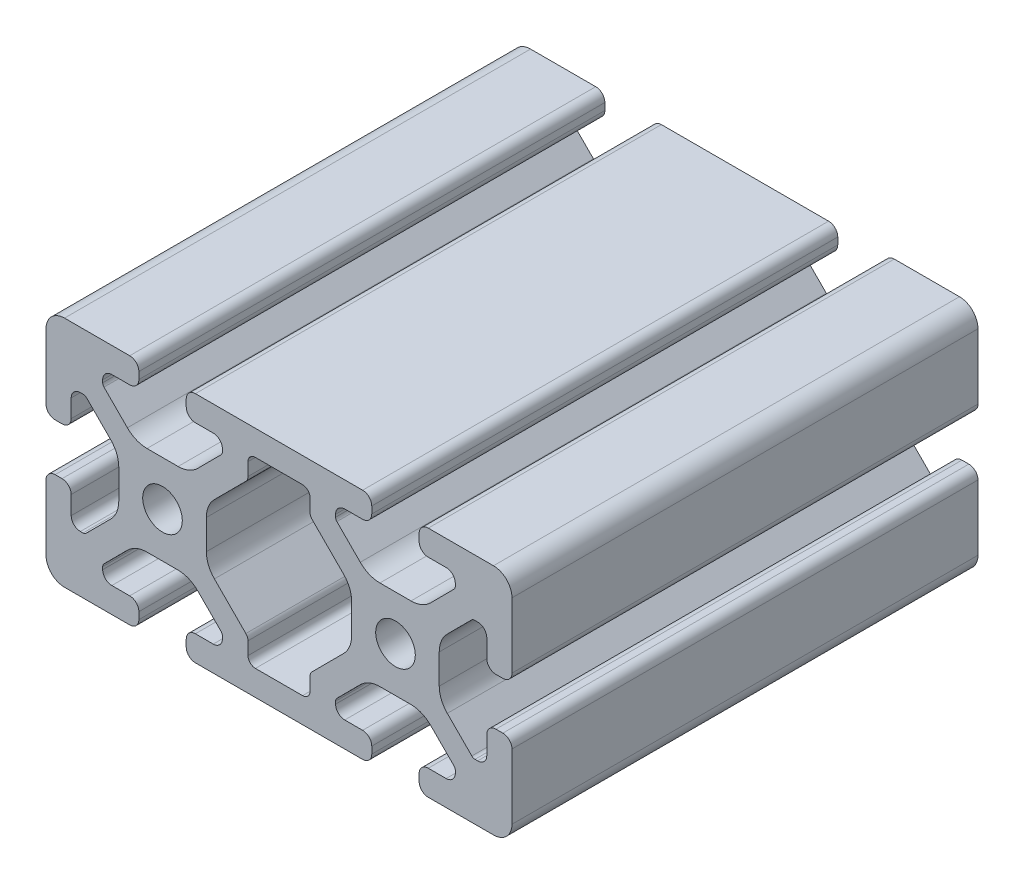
SolidWorks part; units mm, degrees
ref_plane "Front Plane" through (0, 0, 0) normal (0, 0, 1) x (1, 0, 0)
ref_plane "Top Plane" through (0, 0, 0) normal (0, 1, 0) x (1, 0, 0)
ref_plane "Right Plane" through (0, 0, 0) normal (1, 0, 0) x (0, 0, -1)
sketch "Sketch1" plane through (0, 0, 0) normal (0, 0, 1) x (1, 0, 0)
  line L0 (-11.0896, -5.8967) -> (-5.6905, -11.3172)
  line L1 (-12.4742, 2.5438) -> (-12.4742, -2.5446)
  line L2 (-5.6905, 11.3164) -> (-11.0896, 5.8959)
  line L3 (-5.3203, 14.414) -> (-5.3203, 12.2127)
  line L4 (4.0503, 15.684) -> (-4.0503, 15.684)
  line L5 (5.3203, 12.2127) -> (5.3203, 14.414)
  line L6 (11.0896, 5.8959) -> (5.6905, 11.3164)
  line L7 (12.4742, -2.5446) -> (12.4742, 2.5438)
  line L8 (5.6905, -11.3172) -> (11.0896, -5.8967)
  line L9 (5.3203, -14.4147) -> (5.3203, -12.2134)
  line L10 (-4.0503, -15.6847) -> (4.0503, -15.6847)
  line L11 (-5.3203, -12.2134) -> (-5.3203, -14.4147)
  line L12 (15.9245, -18.4422) -> (15.9245, -17.2547)
  line L13 (14.3545, -15.6847) -> (11.2855, -15.6847)
  line L14 (9.7155, -14.1147) -> (9.7155, -13.6719)
  line L15 (9.9371, -13.1355) -> (13.9554, -9.1012)
  line L16 (17.3208, -7.7033) -> (22.6621, -7.7033)
  line L17 (26.0275, -9.1012) -> (30.0459, -13.1355)
  line L18 (30.2674, -13.6719) -> (30.2674, -14.1147)
  line L19 (28.6974, -15.6847) -> (25.6285, -15.6847)
  line L20 (24.0585, -17.2547) -> (24.0585, -18.4422)
  line L21 (25.6285, -20.0122) -> (36.8191, -20.0122)
  line L22 (39.9991, -16.8322) -> (39.9991, -5.6416)
  line L23 (38.4291, -4.0716) -> (37.2416, -4.0716)
  line L24 (35.6716, -5.6416) -> (35.6716, -8.7814)
  line L25 (34.1016, -10.3514) -> (33.6462, -10.3514)
  line L26 (33.1077, -10.1278) -> (28.8933, -5.8967)
  line L27 (27.5087, -2.5446) -> (27.5087, 2.5438)
  line L28 (28.8933, 5.8959) -> (33.0499, 10.069)
  line L29 (33.5884, 10.2927) -> (34.1016, 10.2927)
  line L30 (35.6716, 8.7227) -> (35.6716, 5.6409)
  line L31 (37.2416, 4.0709) -> (38.4291, 4.0709)
  line L32 (39.9991, 5.6409) -> (39.9991, 16.8315)
  line L33 (36.8191, 20.0115) -> (25.6285, 20.0115)
  line L34 (24.0585, 18.4415) -> (24.0585, 17.254)
  line L35 (25.6285, 15.684) -> (28.6974, 15.684)
  line L36 (30.2674, 14.114) -> (30.2674, 13.6712)
  line L37 (30.0459, 13.1348) -> (26.0275, 9.1005)
  line L38 (22.6621, 7.7026) -> (17.3208, 7.7026)
  line L39 (13.9554, 9.1005) -> (9.9371, 13.1348)
  line L40 (9.7155, 13.6712) -> (9.7155, 14.114)
  line L41 (11.2855, 15.684) -> (14.3545, 15.684)
  line L42 (15.9245, 17.254) -> (15.9245, 18.4415)
  line L43 (14.3545, 20.0115) -> (-14.3545, 20.0115)
  line L44 (-15.9245, 18.4415) -> (-15.9245, 17.254)
  line L45 (-14.3545, 15.684) -> (-11.2855, 15.684)
  line L46 (-9.7155, 14.114) -> (-9.7155, 13.6712)
  line L47 (-9.9371, 13.1348) -> (-13.9554, 9.1005)
  line L48 (-17.3208, 7.7026) -> (-22.6621, 7.7026)
  line L49 (-26.0275, 9.1005) -> (-30.0459, 13.1348)
  line L50 (-30.2674, 13.6712) -> (-30.2674, 14.114)
  line L51 (-28.6974, 15.684) -> (-25.6285, 15.684)
  line L52 (-24.0585, 17.254) -> (-24.0585, 18.4415)
  line L53 (-25.6285, 20.0115) -> (-36.8191, 20.0115)
  line L54 (-39.9991, 16.8315) -> (-39.9991, 5.6409)
  line L55 (-38.4291, 4.0709) -> (-37.2416, 4.0709)
  line L56 (-35.6716, 5.6409) -> (-35.6716, 8.7227)
  line L57 (-34.1016, 10.2927) -> (-33.5884, 10.2927)
  line L58 (-33.0499, 10.069) -> (-28.8933, 5.8959)
  line L59 (-27.5087, 2.5438) -> (-27.5087, -2.5446)
  line L60 (-28.8933, -5.8967) -> (-33.1077, -10.1278)
  line L61 (-33.6462, -10.3514) -> (-34.1016, -10.3514)
  line L62 (-35.6716, -8.7814) -> (-35.6716, -5.6416)
  line L63 (-37.2416, -4.0716) -> (-38.4291, -4.0716)
  line L64 (-39.9991, -5.6416) -> (-39.9991, -16.8322)
  line L65 (-36.8191, -20.0122) -> (-25.6285, -20.0122)
  line L66 (-24.0585, -18.4422) -> (-24.0585, -17.2547)
  line L67 (-25.6285, -15.6847) -> (-28.6974, -15.6847)
  line L68 (-30.2674, -14.1147) -> (-30.2674, -13.6719)
  line L69 (-30.0459, -13.1355) -> (-26.0275, -9.1012)
  line L70 (-22.6621, -7.7033) -> (-17.3208, -7.7033)
  line L71 (-13.9554, -9.1012) -> (-9.9371, -13.1355)
  line L72 (-9.7155, -13.6719) -> (-9.7155, -14.1147)
  line L73 (-11.2855, -15.6847) -> (-14.3545, -15.6847)
  line L74 (-15.9245, -17.2547) -> (-15.9245, -18.4422)
  line L75 (-14.3545, -20.0122) -> (14.3545, -20.0122)
  circle A0 centre (20, 0) radius 3.4
  circle A1 centre (-20, 0) radius 3.4
  arc A2 (38.4291, 4.0709) -> (39.9991, 5.6409) centre (38.4291, 5.6409) ccw
  arc A3 (39.9991, -5.6416) -> (38.4291, -4.0716) centre (38.4291, -5.6416) ccw
  arc A4 (37.2416, -4.0716) -> (35.6716, -5.6416) centre (37.2416, -5.6416) ccw
  arc A5 (24.0585, -18.4422) -> (25.6285, -20.0122) centre (25.6285, -18.4422) ccw
  arc A6 (25.6285, -15.6847) -> (24.0585, -17.2547) centre (25.6285, -17.2547) ccw
  arc A7 (15.9245, -18.4422) -> (14.3545, -20.0122) centre (14.3545, -18.4422) cw
  arc A8 (15.9245, -17.2547) -> (14.3545, -15.6847) centre (14.3545, -17.2547) ccw
  arc A9 (35.6716, 5.6409) -> (37.2416, 4.0709) centre (37.2416, 5.6409) ccw
  arc A10 (25.6285, 20.0115) -> (24.0585, 18.4415) centre (25.6285, 18.4415) ccw
  arc A11 (24.0585, 17.254) -> (25.6285, 15.684) centre (25.6285, 17.254) ccw
  arc A12 (14.3545, 15.684) -> (15.9245, 17.254) centre (14.3545, 17.254) ccw
  arc A13 (15.9245, 18.4415) -> (14.3545, 20.0115) centre (14.3545, 18.4415) ccw
  arc A14 (-25.6285, -20.0122) -> (-24.0585, -18.4422) centre (-25.6285, -18.4422) ccw
  arc A15 (-15.9245, -18.4422) -> (-14.3545, -20.0122) centre (-14.3545, -18.4422) ccw
  arc A16 (-14.3545, -15.6847) -> (-15.9245, -17.2547) centre (-14.3545, -17.2547) ccw
  arc A17 (-24.0585, -17.2547) -> (-25.6285, -15.6847) centre (-25.6285, -17.2547) ccw
  arc A18 (-38.4291, -4.0716) -> (-39.9991, -5.6416) centre (-38.4291, -5.6416) ccw
  arc A19 (-35.6716, -5.6416) -> (-37.2416, -4.0716) centre (-37.2416, -5.6416) ccw
  arc A20 (-39.9991, 5.6409) -> (-38.4291, 4.0709) centre (-38.4291, 5.6409) ccw
  arc A21 (-37.2416, 4.0709) -> (-35.6716, 5.6409) centre (-37.2416, 5.6409) ccw
  arc A22 (-14.3545, 20.0115) -> (-15.9245, 18.4415) centre (-14.3545, 18.4415) ccw
  arc A23 (-15.9245, 17.254) -> (-14.3545, 15.684) centre (-14.3545, 17.254) ccw
  arc A24 (-25.6285, 15.684) -> (-24.0585, 17.254) centre (-25.6285, 17.254) ccw
  arc A25 (-24.0585, 18.4415) -> (-25.6285, 20.0115) centre (-25.6285, 18.4415) ccw
  arc A26 (-36.8191, -20.0122) -> (-39.9991, -16.8322) centre (-36.8191, -16.8322) cw
  arc A27 (36.8191, -20.0122) -> (39.9991, -16.8322) centre (36.8191, -16.8322) ccw
  arc A28 (39.9991, 16.8315) -> (36.8191, 20.0115) centre (36.8191, 16.8315) ccw
  arc A29 (-36.8191, 20.0115) -> (-39.9991, 16.8315) centre (-36.8191, 16.8315) ccw
  arc A30 (-33.5884, 10.2927) -> (-33.0499, 10.069) centre (-33.5884, 9.5327) cw
  arc A31 (-33.1077, -10.1278) -> (-33.6462, -10.3514) centre (-33.6462, -9.5914) cw
  arc A32 (-30.2674, -13.6719) -> (-30.0459, -13.1355) centre (-29.5074, -13.6719) cw
  arc A33 (-9.9371, -13.1355) -> (-9.7155, -13.6719) centre (-10.4755, -13.6719) cw
  arc A34 (9.7155, -13.6719) -> (9.9371, -13.1355) centre (10.4755, -13.6719) cw
  arc A35 (30.0459, -13.1355) -> (30.2674, -13.6719) centre (29.5074, -13.6719) cw
  arc A36 (33.6462, -10.3514) -> (33.1077, -10.1278) centre (33.6462, -9.5914) cw
  arc A37 (33.0499, 10.069) -> (33.5884, 10.2927) centre (33.5884, 9.5327) cw
  arc A38 (30.2674, 13.6712) -> (30.0459, 13.1348) centre (29.5074, 13.6712) cw
  arc A39 (9.9371, 13.1348) -> (9.7155, 13.6712) centre (10.4755, 13.6712) cw
  arc A40 (-9.7155, 13.6712) -> (-9.9371, 13.1348) centre (-10.4755, 13.6712) cw
  arc A41 (-30.0459, 13.1348) -> (-30.2674, 13.6712) centre (-29.5074, 13.6712) cw
  arc A42 (-35.6716, 8.7227) -> (-34.1016, 10.2927) centre (-34.1016, 8.7227) cw
  arc A43 (-34.1016, -10.3514) -> (-35.6716, -8.7814) centre (-34.1016, -8.7814) cw
  arc A44 (-28.6974, -15.6847) -> (-30.2674, -14.1147) centre (-28.6974, -14.1147) cw
  arc A45 (-9.7155, -14.1147) -> (-11.2855, -15.6847) centre (-11.2855, -14.1147) cw
  arc A46 (11.2855, -15.6847) -> (9.7155, -14.1147) centre (11.2855, -14.1147) cw
  arc A47 (30.2674, -14.1147) -> (28.6974, -15.6847) centre (28.6974, -14.1147) cw
  arc A48 (35.6716, -8.7814) -> (34.1016, -10.3514) centre (34.1016, -8.7814) cw
  arc A49 (34.1016, 10.2927) -> (35.6716, 8.7227) centre (34.1016, 8.7227) cw
  arc A50 (28.6974, 15.684) -> (30.2674, 14.114) centre (28.6974, 14.114) cw
  arc A51 (9.7155, 14.114) -> (11.2855, 15.684) centre (11.2855, 14.114) cw
  arc A52 (-11.2855, 15.684) -> (-9.7155, 14.114) centre (-11.2855, 14.114) cw
  arc A53 (-30.2674, 14.114) -> (-28.6974, 15.684) centre (-28.6974, 14.114) cw
  arc A54 (11.0896, 5.8959) -> (12.4742, 2.5438) centre (7.7242, 2.5438) cw
  arc A55 (12.4742, -2.5446) -> (11.0896, -5.8967) centre (7.7242, -2.5446) cw
  arc A56 (-11.0896, -5.8967) -> (-12.4742, -2.5446) centre (-7.7242, -2.5446) cw
  arc A57 (-12.4742, 2.5438) -> (-11.0896, 5.8959) centre (-7.7242, 2.5438) cw
  arc A58 (-5.6905, -11.3172) -> (-5.3203, -12.2134) centre (-6.5903, -12.2134) cw
  arc A59 (-4.0503, -15.6847) -> (-5.3203, -14.4147) centre (-4.0503, -14.4147) cw
  arc A60 (5.3203, -14.4147) -> (4.0503, -15.6847) centre (4.0503, -14.4147) cw
  arc A61 (5.6905, -11.3172) -> (5.3203, -12.2134) centre (6.5903, -12.2134) ccw
  arc A62 (5.3203, 12.2127) -> (5.6905, 11.3164) centre (6.5903, 12.2127) ccw
  arc A63 (4.0503, 15.684) -> (5.3203, 14.414) centre (4.0503, 14.414) cw
  arc A64 (-5.3203, 14.414) -> (-4.0503, 15.684) centre (-4.0503, 14.414) cw
  arc A65 (-5.6905, 11.3164) -> (-5.3203, 12.2127) centre (-6.5903, 12.2127) ccw
  arc A66 (22.6621, -7.7033) -> (26.0275, -9.1012) centre (22.6621, -12.4533) cw
  arc A67 (13.9554, -9.1012) -> (17.3208, -7.7033) centre (17.3208, -12.4533) cw
  arc A68 (26.0275, 9.1005) -> (22.6621, 7.7026) centre (22.6621, 12.4526) cw
  arc A69 (17.3208, 7.7026) -> (13.9554, 9.1005) centre (17.3208, 12.4526) cw
  arc A70 (-26.0275, -9.1012) -> (-22.6621, -7.7033) centre (-22.6621, -12.4533) cw
  arc A71 (-17.3208, -7.7033) -> (-13.9554, -9.1012) centre (-17.3208, -12.4533) cw
  arc A72 (-13.9554, 9.1005) -> (-17.3208, 7.7026) centre (-17.3208, 12.4526) cw
  arc A73 (-22.6621, 7.7026) -> (-26.0275, 9.1005) centre (-22.6621, 12.4526) cw
  arc A74 (28.8933, -5.8967) -> (27.5087, -2.5446) centre (32.2587, -2.5446) cw
  arc A75 (27.5087, 2.5438) -> (28.8933, 5.8959) centre (32.2587, 2.5438) cw
  arc A76 (-27.5087, -2.5446) -> (-28.8933, -5.8967) centre (-32.2587, -2.5446) cw
  arc A77 (-28.8933, 5.8959) -> (-27.5087, 2.5438) centre (-32.2587, 2.5438) cw
  point P2 (39.9991, 4.0709)
  point P85 (39.9991, -4.0716)
  point P88 (35.6716, -4.0716)
  point P91 (24.0585, -20.0122)
  point P94 (24.0585, -15.6847)
  point P97 (15.9245, -20.0122)
  point P100 (15.9245, -15.6847)
  point P103 (35.6716, 4.0709)
  point P106 (24.0585, 20.0115)
  point P109 (24.0585, 15.684)
  point P112 (15.9245, 15.684)
  point P115 (15.9245, 20.0115)
  point P118 (-24.0585, -20.0122)
  point P121 (-15.9245, -20.0122)
  point P124 (-15.9245, -15.6847)
  point P127 (-24.0585, -15.6847)
  point P130 (-39.9991, -4.0716)
  point P133 (-35.6716, -4.0716)
  point P136 (-39.9991, 4.0709)
  point P139 (-35.6716, 4.0709)
  point P142 (-15.9245, 20.0115)
  point P145 (-15.9245, 15.684)
  point P148 (-24.0585, 15.684)
  point P151 (-24.0585, 20.0115)
  point P154 (-39.9991, -20.0122)
  point P157 (39.9991, -20.0122)
  point P160 (39.9991, 20.0115)
  point P163 (-39.9991, 20.0115)
  point P166 (-33.2727, 10.2927)
  point P169 (-33.3305, -10.3514)
  point P172 (-30.2674, -13.3579)
  point P175 (-9.7155, -13.3579)
  point P178 (9.7155, -13.3579)
  point P181 (30.2674, -13.3579)
  point P184 (33.3305, -10.3514)
  point P187 (33.2727, 10.2927)
  point P190 (30.2674, 13.3572)
  point P193 (9.7155, 13.3572)
  point P196 (-9.7155, 13.3572)
  point P199 (-30.2674, 13.3572)
  point P202 (-35.6716, 10.2927)
  point P205 (-35.6716, -10.3514)
  point P208 (-30.2674, -15.6847)
  point P211 (-9.7155, -15.6847)
  point P214 (9.7155, -15.6847)
  point P217 (30.2674, -15.6847)
  point P220 (35.6716, -10.3514)
  point P223 (35.6716, 10.2927)
  point P226 (30.2674, 15.684)
  point P229 (9.7155, 15.684)
  point P232 (-9.7155, 15.684)
  point P235 (-30.2674, 15.684)
  point P238 (12.4742, 4.5059)
  point P241 (12.4742, -4.5066)
  point P244 (-12.4742, -4.5066)
  point P247 (-12.4742, 4.5059)
  point P250 (-5.3203, -11.6888)
  point P253 (-5.3203, -15.6847)
  point P256 (5.3203, -15.6847)
  point P259 (5.3203, -11.6888)
  point P262 (5.3203, 11.6881)
  point P265 (5.3203, 15.684)
  point P268 (-5.3203, 15.684)
  point P271 (-5.3203, 11.6881)
  point P274 (24.6351, -7.7033)
  point P277 (15.3478, -7.7033)
  point P280 (24.6351, 7.7026)
  point P283 (15.3478, 7.7026)
  point P286 (-24.6351, -7.7033)
  point P289 (-15.3478, -7.7033)
  point P292 (-15.3478, 7.7026)
  point P295 (-24.6351, 7.7026)
  point P298 (27.5087, -4.5066)
  point P301 (27.5087, 4.5059)
  point P304 (-27.5087, -4.5066)
  point P307 (-27.5087, 4.5059)
  dimension "D1" = 1.57
  dimension "D2" = 3.18
  dimension "D3" = 0.76
  dimension "D4" = 1.57
  dimension "D5" = 4.75
  dimension "D6" = 1.27
  dimension "D7" = 4.75
extrude "Extrude1" add sketch "Sketch1" along normal mid plane 80
